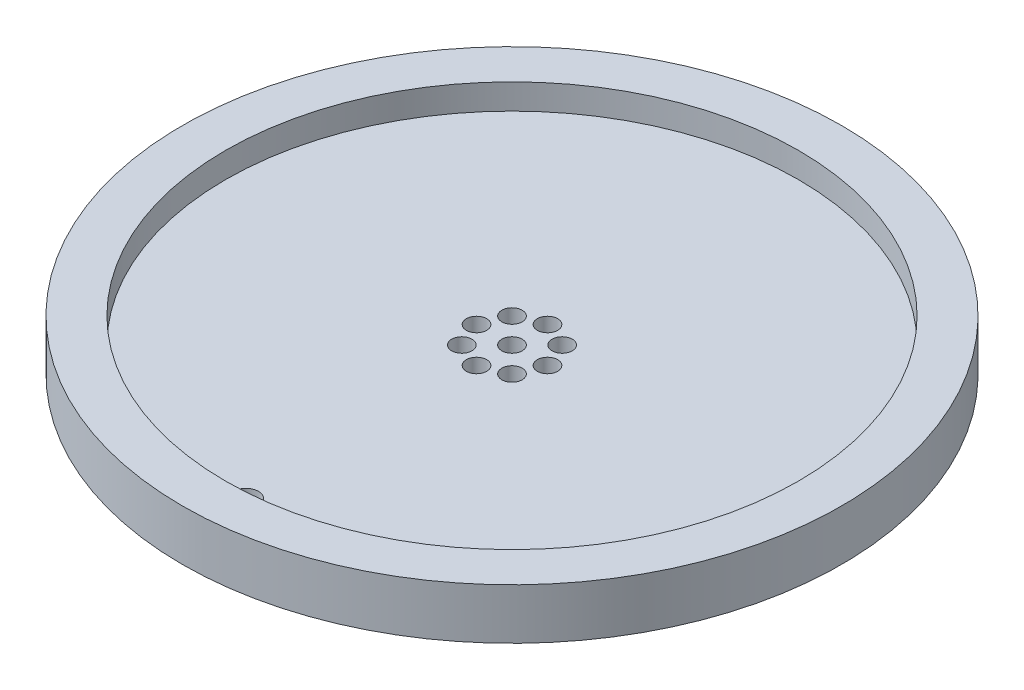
SolidWorks part; units mm, degrees
ref_plane "Front Plane" through (0, 0, 0) normal (0, 0, 1) x (1, 0, 0)
ref_plane "Top Plane" through (0, 0, 0) normal (0, 1, 0) x (1, 0, 0)
ref_plane "Right Plane" through (0, 0, 0) normal (1, 0, 0) x (0, 0, -1)
sketch "Sketch2" plane through (0, 0, 0) normal (0, 1, 0) x (1, 0, 0)
  line L0 (0, 7) -> (0, -7) construction
  line L1 (-7, 0) -> (7, 0) construction
  line L2 (-4.9497, 4.9497) -> (4.9497, -4.9497) construction
  line L3 (-4.9497, -4.9497) -> (4.9497, 4.9497) construction
  circle A0 centre (0, 0) radius 65
  circle A1 centre (0, 0) radius 2
  circle A2 centre (0, 7) radius 2
  circle A3 centre (4.9497, 4.9497) radius 2
  circle A4 centre (7, 0) radius 2
  circle A5 centre (4.9497, -4.9497) radius 2
  circle A6 centre (0, -7) radius 2
  circle A7 centre (-4.9497, -4.9497) radius 2
  circle A8 centre (-7, 0) radius 2
  circle A9 centre (-4.9497, 4.9497) radius 2
  point P7 (0, 0)
  point P10 (0, 0)
  point P13 (0, 0)
  point P16 (0, 0)
  dimension "D1" = 130
  dimension "D2" = 4
  dimension "D6" = 4
  dimension "D3" = 14
  dimension "D4" = 45
  dimension "D5" = 45
extrude "Boss-Extrude1" add sketch "Sketch2" along normal blind 5
sketch "Sketch3" plane through (0, 0, 0) normal (0, -1, 0) x (1, 0, 0)
  line L0 (0, 52.5) -> (0, -52.5) construction
  circle A0 centre (0, 52.5) radius 2.5
  point P5 (0, 0)
  dimension "D2" = 5
  dimension "D1" = 105
extrude "Cut-Extrude1" cut sketch "Sketch3" against normal blind 5
sketch "Sketch6" plane through (0, 5, 0) normal (0, 1, 0) x (1, 0, 0)
  circle A0 centre (0, 0) radius 59
  circle A1 centre (0, 0) radius 65
  circle A2 centre (0, 0) radius 65
  dimension "D1" = 0
  dimension "D2" = 6
extrude "Boss-Extrude2" add sketch "Sketch6" along normal blind 5
sketch "Sketch7" plane through (0, 5, 0) normal (0, 1, 0) x (1, 0, 0)
  circle A0 centre (0, 0) radius 56.5
  circle A1 centre (0, 0) radius 59
  circle A2 centre (0, 0) radius 59
  dimension "D2" = 2.5
  dimension "D1" = 0
extrude "Boss-Extrude3" add sketch "Sketch7" along normal up to surface (5 mm away)
